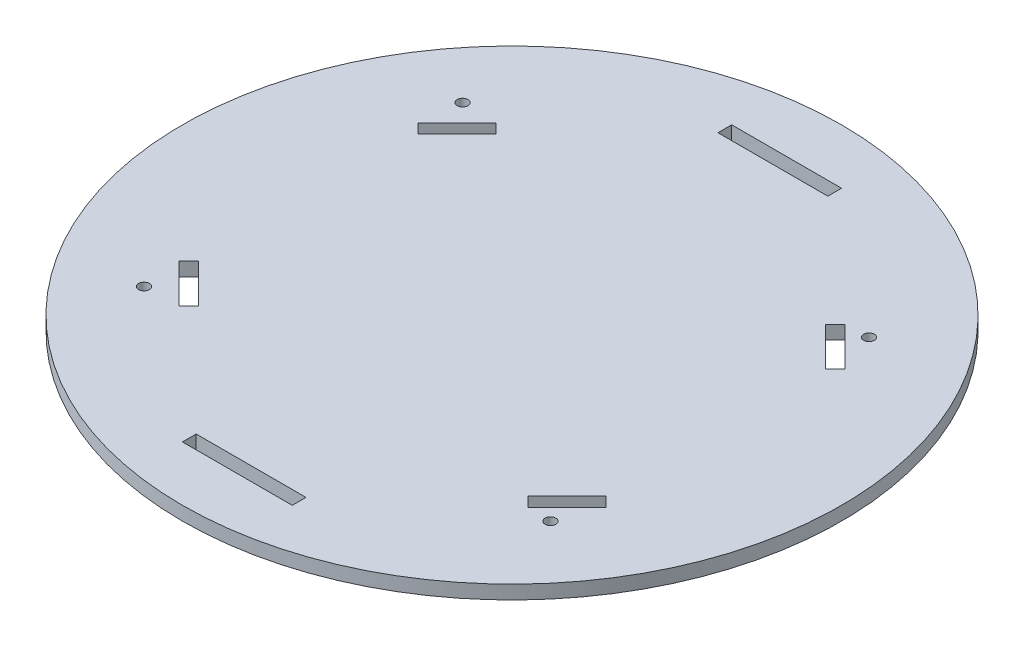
SolidWorks part; units mm, degrees
ref_plane "Front Plane" through (0, 0, 0) normal (0, 0, 1) x (1, 0, 0)
ref_plane "Top Plane" through (0, 0, 0) normal (0, 1, 0) x (1, 0, 0)
ref_plane "Right Plane" through (0, 0, 0) normal (1, 0, 0) x (0, 0, -1)
sketch "Sketch1" plane through (0, 0, 0) normal (0, 1, 0) x (1, 0, 0)
  circle A0 centre (0, 0) radius 76.2
  dimension "D1" = 152.4
extrude "Extrude1" add sketch "Sketch1" along normal mid plane 3.175
sketch "Sketch4" plane through (0, 1.5875, 0) normal (0, 1, 0) x (1, 0, 0)
  line L0 (-40.3451, 36.6253) -> (-49.3253, 27.6451)
  line L1 (-40.3451, 36.6253) -> (-38.1, 34.3803)
  line L2 (-49.3253, 27.6451) -> (-47.0803, 25.4)
  line L3 (-38.1, 34.3803) -> (-47.0803, 25.4)
  line L4 (-143.4149, 0) -> (143.4149, 0) construction
  line L5 (0, 32.2759) -> (0, -101.835) construction
  line L6 (38.1, 34.3803) -> (47.0803, 25.4)
  line L7 (49.3253, 27.6451) -> (47.0803, 25.4)
  line L8 (40.3451, 36.6253) -> (38.1, 34.3803)
  line L9 (40.3451, 36.6253) -> (49.3253, 27.6451)
  line L10 (40.3451, -36.6253) -> (49.3253, -27.6451)
  line L11 (40.3451, -36.6253) -> (38.1, -34.3803)
  line L12 (49.3253, -27.6451) -> (47.0803, -25.4)
  line L13 (38.1, -34.3803) -> (47.0803, -25.4)
  line L14 (-38.1, -34.3803) -> (-47.0803, -25.4)
  line L15 (-49.3253, -27.6451) -> (-47.0803, -25.4)
  line L16 (-40.3451, -36.6253) -> (-38.1, -34.3803)
  line L17 (-40.3451, -36.6253) -> (-49.3253, -27.6451)
  point P6 (0, 0)
  dimension "D1" = 12.7
  dimension "D2" = 3.175
  dimension "D3" = 45
  dimension "D4" = 25.4
  dimension "D5" = 38.1
extrude "Cut-Extrude2" cut sketch "Sketch4" against normal through all
sketch "Sketch5" plane through (0, 1.5875, 0) normal (0, 1, 0) x (1, 0, 0)
  line L0 (-97.9439, 0) -> (98.1339, 0) construction
  line L1 (-12.7, -60.325) -> (12.7, -60.325)
  line L2 (-12.7, -60.325) -> (-12.7, -63.5)
  line L3 (-12.7, -63.5) -> (12.7, -63.5)
  line L4 (12.7, -60.325) -> (12.7, -63.5)
  line L5 (-12.7, -60.325) -> (12.7, -63.5) construction
  line L6 (-12.7, -63.5) -> (12.7, -60.325) construction
  line L7 (-12.7, 63.5) -> (12.7, 60.325) construction
  line L8 (-12.7, 60.325) -> (12.7, 63.5) construction
  line L9 (12.7, 60.325) -> (12.7, 63.5)
  line L10 (-12.7, 63.5) -> (12.7, 63.5)
  line L11 (-12.7, 60.325) -> (-12.7, 63.5)
  line L12 (-12.7, 60.325) -> (12.7, 60.325)
  point P0 (0, -61.9125)
  point P12 (0, 61.9125)
  dimension "D1" = 25.4
  dimension "D2" = 63.5
  dimension "D3" = 3.175
extrude "Cut-Extrude3" cut sketch "Sketch5" against normal through all
hole_wizard "#40 (0.098) Diameter Hole1" positions "Sketch8" profile "Sketch7" hole size "#40" standard "Ansi Inch"
sketch "Sketch8" plane through (0, 1.5875, 0) normal (0, 1, 0) x (-1, 0, 0)
  line L4 (79.7566, 0) -> (-79.4185, 0) construction
  point P0 (48.26, -36.83)
  point P1 (-45.72, -36.83)
  point P35 (-45.72, 36.83)
  point P36 (48.26, 36.83)
  dimension "D1" = 93.98
  dimension "D2" = 48.26
  dimension "D3" = 36.83
sketch "Sketch7" plane through (-48.26, 1.5875, -36.83) normal (1, 0, 0) x (0, 0, 1)
  line L0 (0, 0) -> (0, 3.175)
  line L1 (0, 3.175) -> (1.2446, 3.175)
  line L2 (1.2446, 3.175) -> (1.2446, 0)
  line L5 (1.2446, 0) -> (0, 0)
  line L11 (0, -6.35) -> (0, 107.95) construction
  dimension "Thru Hole Dia." = 2.4892
  dimension "Thru Hole Depth" = 3.175
sketch "Sketch9" plane through (0, 1.5875, 0) normal (0, 1, 0) x (-1, 0, 0)
  text T0 "F"
  text T1 "0"
  text T2 "1"
